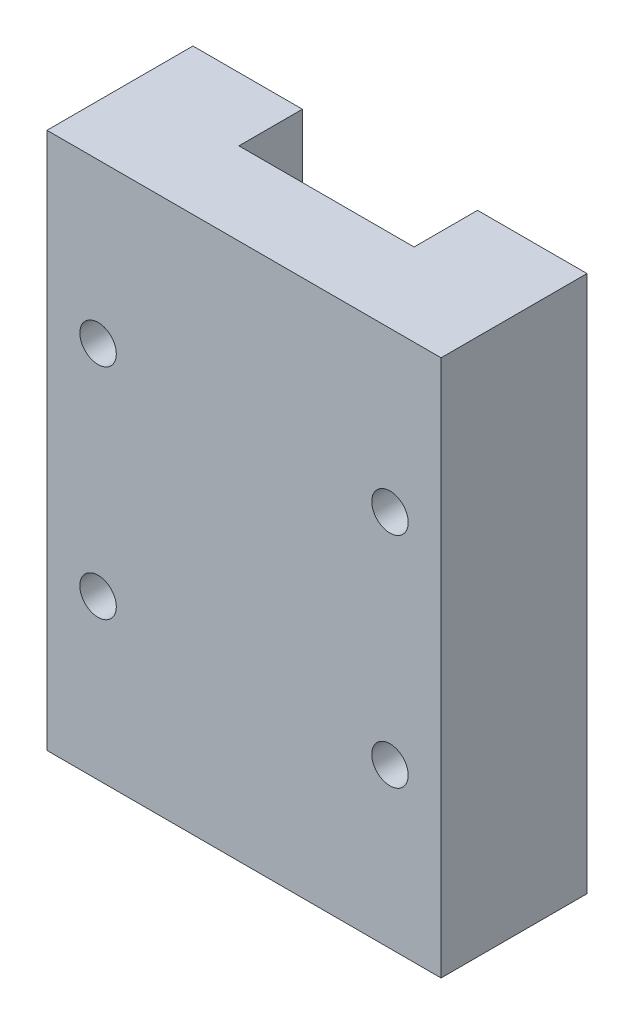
SolidWorks part; units mm, degrees
ref_plane "前视基准面" through (0, 0, 0) normal (0, 0, 1) x (1, 0, 0)
ref_plane "上视基准面" through (0, 0, 0) normal (0, 1, 0) x (1, 0, 0)
ref_plane "右视基准面" through (0, 0, 0) normal (1, 0, 0) x (0, 0, -1)
sketch "草图2" plane through (0, 0, 0) normal (0, 0, 1) x (1, 0, 0)
  line L0 (27, 36.8) -> (27, 0)
  line L1 (0, 36.8) -> (0, 0)
  line L2 (27, 36.8) -> (0, 36.8)
  line L3 (27, 0) -> (0, 0)
  circle A0 centre (23.5, 25.9) radius 1.25
  circle A1 centre (3.5, 25.9) radius 1.25
  circle A2 centre (3.5, 10.9) radius 1.25
  circle A3 centre (23.5, 10.9) radius 1.25
extrude "凸台-拉伸1" add sketch "草图2" along normal blind 10
sketch "草图3" plane through (0, 36.8, 0) normal (0, 1, 0) x (1, 0, 0)
  line L0 (19.5, 0) -> (19.5, -4.35)
  line L1 (7.5, 0) -> (7.5, -4.35)
  line L2 (19.5, -4.35) -> (7.5, -4.35)
extrude "切除-拉伸1" cut sketch "草图3" against normal through all and the other way through all
